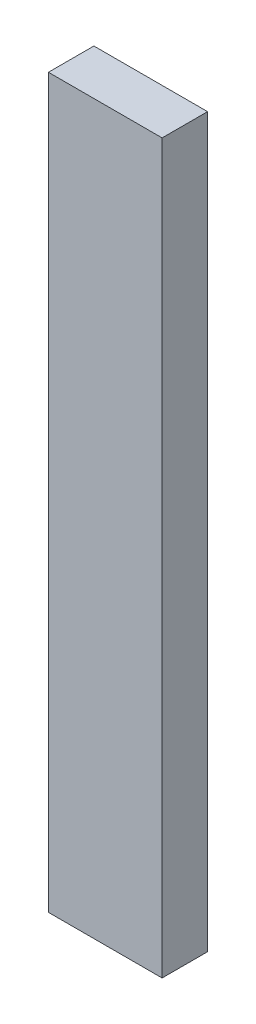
SolidWorks part; units mm, degrees
ref_plane "Plan de face" through (0, 0, 0) normal (0, 0, 1) x (1, 0, 0)
ref_plane "Plan de dessus" through (0, 0, 0) normal (0, 1, 0) x (1, 0, 0)
ref_plane "Plan de droite" through (0, 0, 0) normal (1, 0, 0) x (0, 0, -1)
sketch "Esquisse1" plane through (0, 0, 0) normal (0, 0, 1) x (1, 0, 0)
  line L1 (0, 0) -> (25, 0)
  line L2 (0, 0) -> (0, 160)
  line L3 (0, 160) -> (25, 160)
  line L4 (25, 0) -> (25, 160)
  dimension "D1" = 160
  dimension "D2" = 25
extrude "Boss.-Extru.1" add sketch "Esquisse1" along normal blind 10
sketch "Esquisse2" plane through (0, 0, 0) normal (0, -1, 0) x (1, 0, 0)
  line L0 (0, 10) -> (25, 10) construction
  line L1 (0, 10) -> (0, 0) construction
  circle A0 centre (12.5, 5) radius 0.75
  dimension "D1" = 1.5
  dimension "D2" = 5
  dimension "D3" = 12.5
extrude "Enlèv. mat.-Extru.1" cut sketch "Esquisse2" against normal blind 10
sketch "Esquisse3" plane through (0, 0, 0) normal (0, 0, -1) x (-1, 0, 0)
  line L0 (-25, 0) -> (-25, 160) construction
  line L1 (-25, 160) -> (0, 160) construction
  line L2 (0, 0) -> (-25, 0) construction
  circle A0 centre (-12.5, 150) radius 0.75
  circle A1 centre (-12.5, 128) radius 0.75
  circle A2 centre (-12.5, 106) radius 0.75
  circle A3 centre (-12.5, 45) radius 0.75
  dimension "D1" = 1.5
  dimension "D4" = 32
  dimension "D5" = 1.5
  dimension "D6" = 1.5
  dimension "D8" = 1.5
  dimension "D2" = 12.5
  dimension "D3" = 10
  dimension "D7" = 54
  dimension "D9" = 45
extrude "Enlèv. mat.-Extru.2" cut sketch "Esquisse3" against normal blind 5
